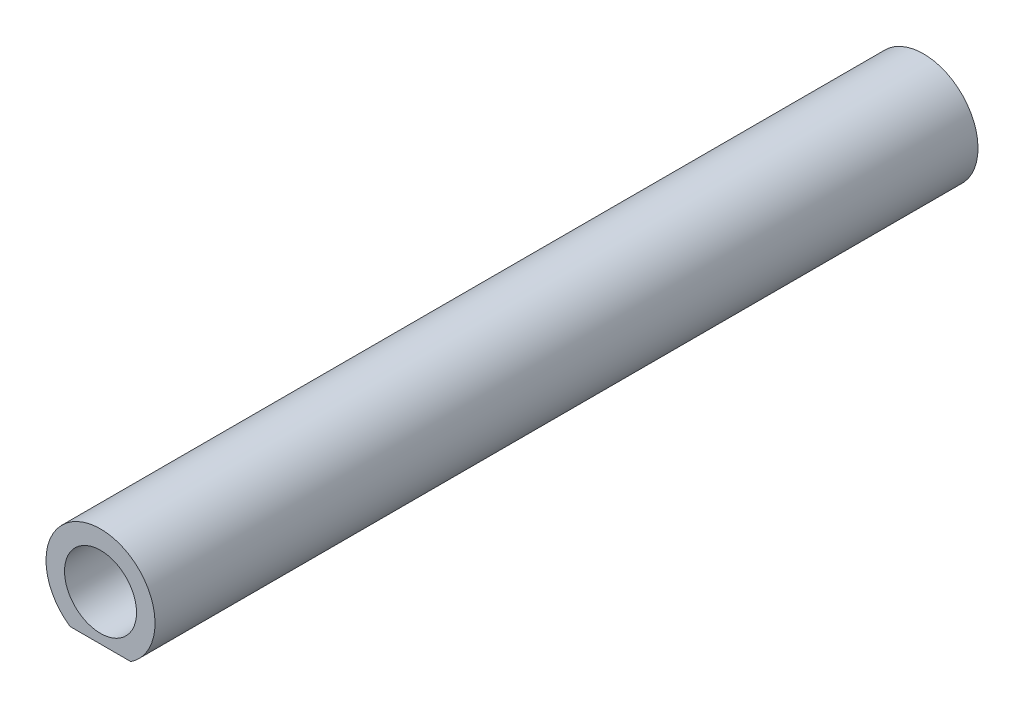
SolidWorks part; units mm, degrees
ref_plane "Front" through (0, 0, 0) normal (0, 0, 1) x (1, 0, 0)
ref_plane "Top" through (0, 0, 0) normal (0, 1, 0) x (1, 0, 0)
ref_plane "Right" through (0, 0, 0) normal (1, 0, 0) x (0, 0, -1)
sketch "Sketch1" plane through (0, 0, 0) normal (0, 0, 1) x (1, 0, 0)
  line L0 (0, -11.1125) -> (0, -16.8275) construction
  line L1 (-9.381, -13.97) -> (9.381, -13.97)
  circle A0 centre (0, 0) radius 11.1125
  circle A1 centre (0, 0) radius 16.8275
  point P9 (0, -13.97)
  dimension "D1" = 33.655
  dimension "D2" = 22.225
  dimension "D3" = 2.8575
  dimension "D4" = 5.715
extrude "Boss-Extrude1" add sketch "Sketch1" along normal blind 254
